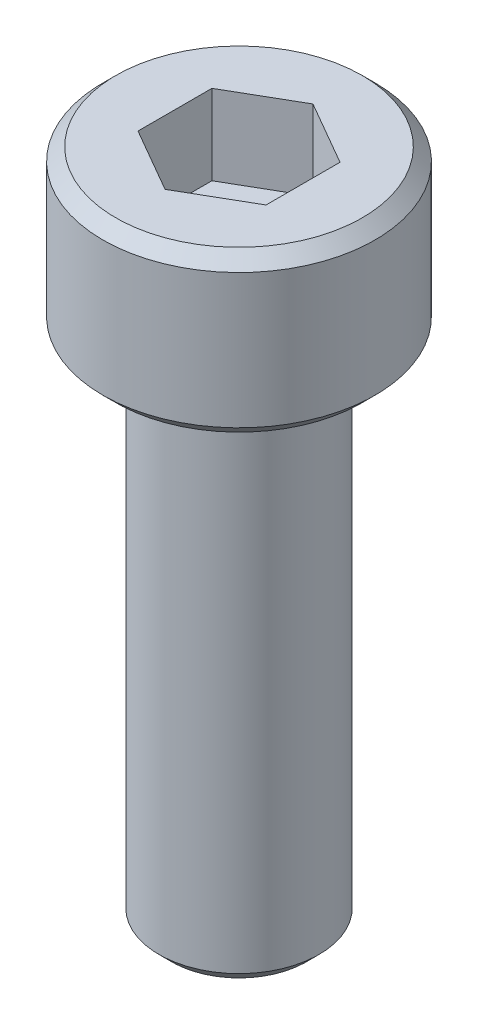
SolidWorks part; units mm, degrees
ref_plane "Face" through (0, 0, 0) normal (0, 0, 1) x (1, 0, 0)
ref_plane "Dessus" through (0, 0, 0) normal (0, 1, 0) x (1, 0, 0)
ref_plane "Droite" through (0, 0, 0) normal (1, 0, 0) x (0, 0, -1)
sketch "Esquisse1" plane through (0, 0, 0) normal (0, 0, 1) x (1, 0, 0)
  line L0 (0, 0) -> (0, 32.1848) construction
  line L1 (0, 0) -> (2.5, 0)
  line L2 (2.5, 0) -> (2.5, 16)
  line L3 (2.5, 16) -> (4.25, 16)
  line L4 (4.25, 16) -> (4.25, 21)
  line L5 (4.25, 21) -> (0, 21)
  line L6 (0, 0) -> (0, 21)
  dimension "D1" = 5
  dimension "D2" = 16
  dimension "D3" = 8.5
  dimension "D4" = 5
revolve "Révolution1" add sketch "Esquisse1" angle 360 about L0
chamfer "Chanfrein1" distance 0.4 angle 45 3 edges at (0, 0, -2.5) (0, 21, -4.25) (0, 16, -4.25)
sketch "Esquisse2" plane through (0, 21, 0) normal (0, 1, 0) x (-1, 0, 0)
  line L1 (-2, 1.1547) -> (-2, -1.1547)
  line L2 (-2, -1.1547) -> (0, -2.3094)
  line L3 (0, -2.3094) -> (2, -1.1547)
  line L4 (2, -1.1547) -> (2, 1.1547)
  line L5 (2, 1.1547) -> (0, 2.3094)
  line L6 (0, 2.3094) -> (-2, 1.1547)
  circle A0 centre (0, 0) radius 2 construction
  dimension "D1" = 4
extrude "Enlèv. mat.-Extru.1" cut sketch "Esquisse2" against normal blind 2.5
